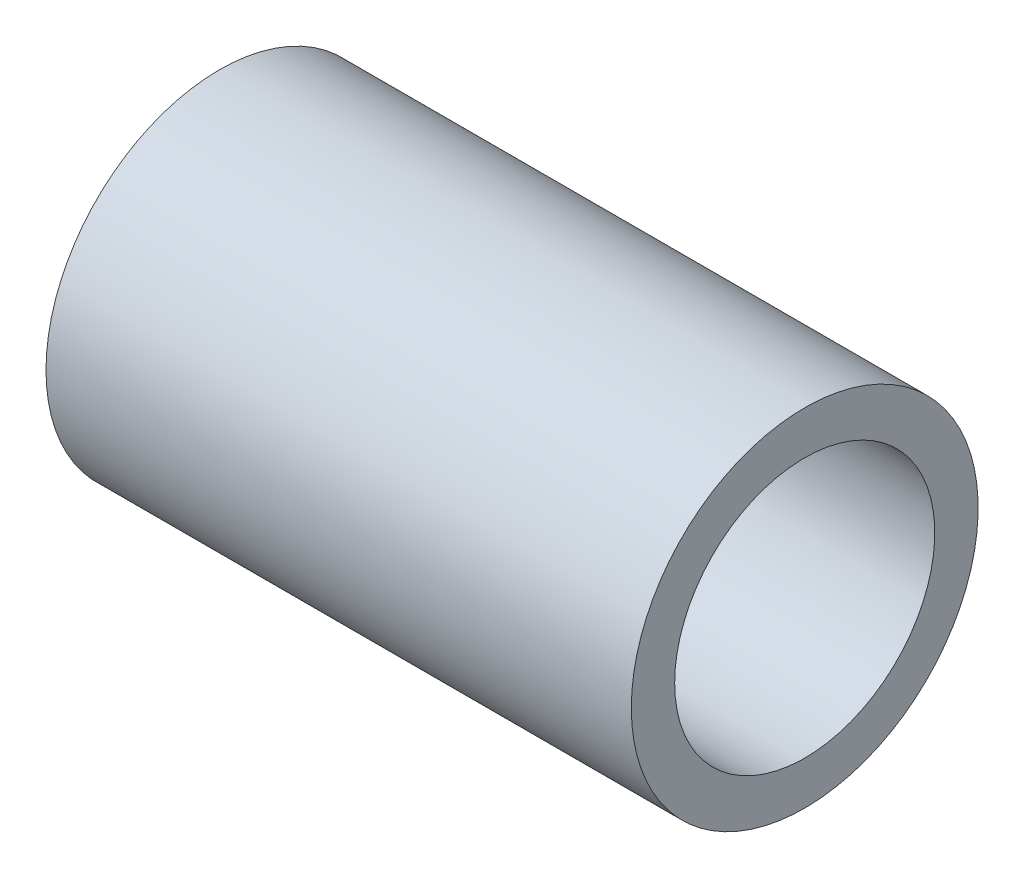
SolidWorks part; units mm, degrees
ref_plane "Front Plane" through (0, 0, 0) normal (0, 0, 1) x (1, 0, 0)
ref_plane "Top Plane" through (0, 0, 0) normal (0, 1, 0) x (1, 0, 0)
ref_plane "Right Plane" through (0, 0, 0) normal (1, 0, 0) x (0, 0, -1)
sketch "Sketch1" plane through (0, 0, 0) normal (0, 0, 1) x (1, 0, 0)
  line L0 (-6.9009, 0) -> (19.9897, 0) construction
  line L2 (0, 3) -> (13.5, 3)
  line L3 (13.5, 3) -> (13.5, 4)
  line L4 (13.5, 4) -> (0, 4)
  line L5 (0, 4) -> (0, 3)
  dimension "D1" = 4
  dimension "D2" = 13.5
  dimension "D3" = 3
revolve "Revolve1" add sketch "Sketch1" angle 360 about L0
sketch "Sketch3" plane through (0, 0, 0) normal (0, 0, 1) x (1, 0, 0)
  line L0 (0, 1) -> (6.5, 1)
  line L1 (0, 3) -> (0, -3) construction
  line L2 (6.5, -1) -> (0, -1)
  line L3 (0, -1) -> (0, 1)
  arc A0 (6.5, 1) -> (6.5, -1) centre (6.5, 0) cw
  dimension "D1" = 2
  dimension "D2" = 1
  dimension "D3" = 6.5
extrude "Cut-Extrude2" cut sketch "Sketch3" against normal through all
